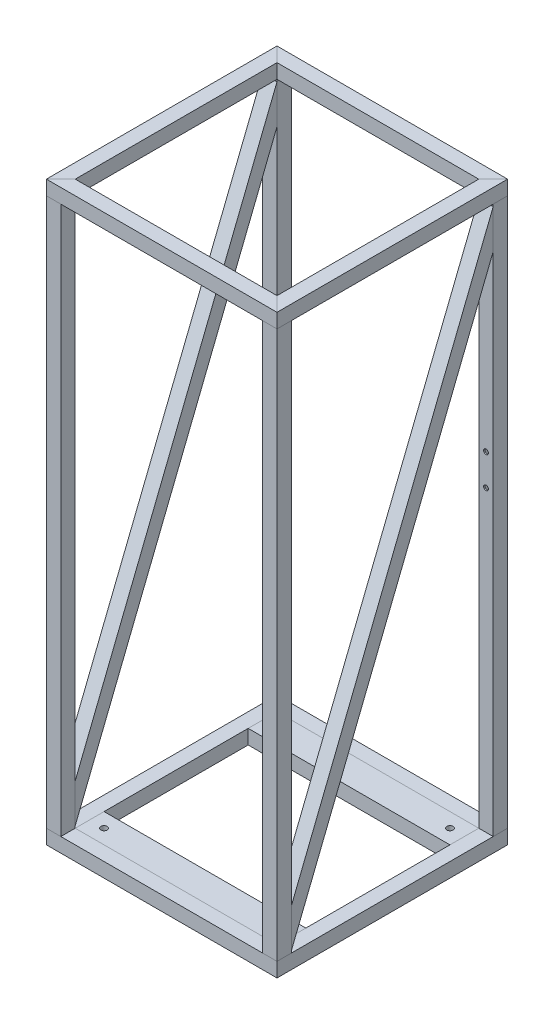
SolidWorks part; units mm, degrees
ref_plane "Front Plane" through (0, 0, 0) normal (0, 0, 1) x (1, 0, 0)
ref_plane "Top Plane" through (0, 0, 0) normal (0, 1, 0) x (1, 0, 0)
ref_plane "Right Plane" through (0, 0, 0) normal (1, 0, 0) x (0, 0, -1)
sketch3d "3DSketch7"
  line L0 (0, 0, 0) -> (609.6, 0, 0)
  line L1 (609.6, 0, 0) -> (609.6, 1524, 0)
  line L2 (609.6, 1524, 0) -> (0, 1524, 0)
  line L3 (0, 1524, 0) -> (0, 0, 0)
  line L4 (0, 0, 0) -> (0, 0, 609.6)
  line L5 (0, 0, 609.6) -> (0, 1524, 609.6)
  line L6 (0, 1524, 609.6) -> (0, 1524, 0)
  line L7 (0, 0, 609.6) -> (609.6, 0, 609.6)
  line L8 (609.6, 0, 609.6) -> (609.6, 0, 0)
  line L9 (609.6, 1524, 0) -> (609.6, 1524, 609.6)
  line L10 (609.6, 1524, 609.6) -> (0, 1524, 609.6)
  line L11 (609.6, 1524, 609.6) -> (609.6, 0, 609.6)
  line L12 (609.6, 1524, 0) -> (609.6, 0, 609.6)
  line L13 (0, 1524, 0) -> (0, 0, 609.6)
  line L14 (0, 0, 609.6) -> (0, 0, 608.3224)
other "Structural Member6"
ref_plane "Plane8" through (0, 0, 609.6) normal (0, 1, 0) x (-1, 0, 0)
sketch "Sketch1" plane through (19.05, 0, 590.55) normal (0, 1, 0) x (-1, 0, 0)
  line L1 (-19.05, 19.05) -> (19.05, 19.05)
  line L2 (-19.05, 19.05) -> (-19.05, -19.05)
  line L3 (-19.05, -19.05) -> (19.05, -19.05)
  line L4 (19.05, 19.05) -> (19.05, -19.05)
  line L5 (15.875, 15.875) -> (15.875, -15.875)
  line L6 (-15.875, -15.875) -> (15.875, -15.875)
  line L7 (-15.875, 15.875) -> (-15.875, -15.875)
  line L8 (-15.875, 15.875) -> (15.875, 15.875)
  point P6 (0, 0)
  dimension "D1" = 38.1
  dimension "D2" = 38.1
  dimension "D4" = 19.05
  dimension "D5" = 19.05
  dimension "D3" = 3.175
other "Structural Member7"
ref_plane "Plane9" through (0, 1524, 0) normal (0, -1, 0) x (1, 0, 0)
sketch "Sketch14" plane through (19.05, 1524, 19.05) normal (0, -1, 0) x (1, 0, 0)
  line L1 (-19.05, 19.05) -> (19.05, 19.05)
  line L2 (-19.05, 19.05) -> (-19.05, -19.05)
  line L3 (-19.05, -19.05) -> (19.05, -19.05)
  line L4 (19.05, 19.05) -> (19.05, -19.05)
  line L5 (15.875, 15.875) -> (15.875, -15.875)
  line L6 (-15.875, -15.875) -> (15.875, -15.875)
  line L7 (-15.875, 15.875) -> (-15.875, -15.875)
  line L8 (-15.875, 15.875) -> (15.875, 15.875)
  point P6 (0, 0)
  dimension "D1" = 38.1
  dimension "D2" = 38.1
  dimension "D4" = 19.05
  dimension "D5" = 19.05
  dimension "D3" = 3.175
other "Structural Member8"
ref_plane "Plane10" through (609.6, 1524, 609.6) normal (0, -1, 0) x (1, 0, 0)
sketch "Sketch15" plane through (590.55, 1524, 590.55) normal (0, -1, 0) x (1, 0, 0)
  line L1 (-19.05, 19.05) -> (19.05, 19.05)
  line L2 (-19.05, 19.05) -> (-19.05, -19.05)
  line L3 (-19.05, -19.05) -> (19.05, -19.05)
  line L4 (19.05, 19.05) -> (19.05, -19.05)
  line L5 (15.875, 15.875) -> (15.875, -15.875)
  line L6 (-15.875, -15.875) -> (15.875, -15.875)
  line L7 (-15.875, 15.875) -> (-15.875, -15.875)
  line L8 (-15.875, 15.875) -> (15.875, 15.875)
  point P6 (0, 0)
  dimension "D1" = 38.1
  dimension "D2" = 38.1
  dimension "D4" = 19.05
  dimension "D5" = 19.05
  dimension "D3" = 3.175
other "Structural Member9"
ref_plane "Plane11" through (0, 1524, 0) normal (0, -0.9285, 0.3714) x (1, 0, 0)
sketch "Sketch16" plane through (19.05, 1524, 0) normal (0, -0.9285, 0.3714) x (1, 0, 0)
  line L1 (-19.05, 19.05) -> (19.05, 19.05)
  line L2 (-19.05, 19.05) -> (-19.05, -19.05)
  line L3 (-19.05, -19.05) -> (19.05, -19.05)
  line L4 (19.05, 19.05) -> (19.05, -19.05)
  line L5 (15.875, 15.875) -> (15.875, -15.875)
  line L6 (-15.875, -15.875) -> (15.875, -15.875)
  line L7 (-15.875, 15.875) -> (-15.875, -15.875)
  line L8 (-15.875, 15.875) -> (15.875, 15.875)
  point P6 (0, 0)
  point P10 (-19.05, 0)
  dimension "D1" = 38.1
  dimension "D2" = 38.1
  dimension "D4" = 19.05
  dimension "D5" = 19.05
  dimension "D3" = 3.175
other "Structural Member10"
ref_plane "Plane12" through (609.6, 1524, 0) normal (0, -0.9285, 0.3714) x (1, 0, 0)
sketch "Sketch17" plane through (590.55, 1524, 0) normal (0, -0.9285, 0.3714) x (1, 0, 0)
  line L0 (-590.55, 19.05) -> (-590.55, -19.05) construction
  line L1 (-19.05, 19.05) -> (19.05, 19.05)
  line L2 (-19.05, 19.05) -> (-19.05, -19.05)
  line L3 (-19.05, -19.05) -> (19.05, -19.05)
  line L4 (19.05, 19.05) -> (19.05, -19.05)
  line L5 (15.875, 15.875) -> (15.875, -15.875)
  line L6 (-15.875, -15.875) -> (15.875, -15.875)
  line L7 (-15.875, 15.875) -> (-15.875, -15.875)
  line L8 (-15.875, 15.875) -> (15.875, 15.875)
  line L9 (-552.45, 19.05) -> (-590.55, 19.05) construction
  line L10 (-552.45, -19.05) -> (-552.45, 19.05) construction
  line L11 (-590.55, -19.05) -> (-552.45, -19.05) construction
  point P6 (0, 0)
  point P10 (-590.55, 0)
  point P11 (-571.5, 19.05)
  point P14 (-552.45, 0)
  point P17 (-571.5, -19.05)
  point P20 (19.05, 0)
  dimension "D1" = 38.1
  dimension "D2" = 38.1
  dimension "D4" = 19.05
  dimension "D5" = 19.05
  dimension "D3" = 3.175
other "Structural Member11"
ref_plane "Plane13" through (609.6, 0, 0) normal (0, 1, 0) x (-1, 0, 0)
sketch "Sketch18" plane through (590.55, 0, 19.05) normal (0, 1, 0) x (-1, 0, 0)
  line L1 (-19.05, 19.05) -> (19.05, 19.05)
  line L2 (-19.05, 19.05) -> (-19.05, -19.05)
  line L3 (-19.05, -19.05) -> (19.05, -19.05)
  line L4 (19.05, 19.05) -> (19.05, -19.05)
  line L5 (15.875, 15.875) -> (15.875, -15.875)
  line L6 (-15.875, -15.875) -> (15.875, -15.875)
  line L7 (-15.875, 15.875) -> (-15.875, -15.875)
  line L8 (-15.875, 15.875) -> (15.875, 15.875)
  point P6 (0, 0)
  dimension "D1" = 38.1
  dimension "D2" = 38.1
  dimension "D4" = 19.05
  dimension "D5" = 19.05
  dimension "D3" = 3.175
other "Structural Member12"
ref_plane "Plane14" through (609.6, 1524, 609.6) normal (-1, 0, 0) x (0, 0, 1)
sketch "Sketch19" plane through (609.6, 1504.95, 590.55) normal (-1, 0, 0) x (0, 0, 1)
  line L1 (-19.05, 19.05) -> (19.05, 19.05)
  line L2 (-19.05, 19.05) -> (-19.05, -19.05)
  line L3 (-19.05, -19.05) -> (19.05, -19.05)
  line L4 (19.05, 19.05) -> (19.05, -19.05)
  line L5 (15.875, 15.875) -> (15.875, -15.875)
  line L6 (-15.875, -15.875) -> (15.875, -15.875)
  line L7 (-15.875, 15.875) -> (-15.875, -15.875)
  line L8 (-15.875, 15.875) -> (15.875, 15.875)
  point P6 (0, 0)
  dimension "D1" = 38.1
  dimension "D2" = 38.1
  dimension "D4" = 19.05
  dimension "D5" = 19.05
  dimension "D3" = 3.175
other "Structural Member13"
ref_plane "Plane15" through (0, 1524, 609.6) normal (0, 0, -1) x (-1, 0, 0)
sketch "Sketch110" plane through (19.05, 1504.95, 609.6) normal (0, 0, -1) x (-1, 0, 0)
  line L1 (-19.05, 19.05) -> (19.05, 19.05)
  line L2 (-19.05, 19.05) -> (-19.05, -19.05)
  line L3 (-19.05, -19.05) -> (19.05, -19.05)
  line L4 (19.05, 19.05) -> (19.05, -19.05)
  line L5 (15.875, 15.875) -> (15.875, -15.875)
  line L6 (-15.875, -15.875) -> (15.875, -15.875)
  line L7 (-15.875, 15.875) -> (-15.875, -15.875)
  line L8 (-15.875, 15.875) -> (15.875, 15.875)
  point P6 (0, 0)
  dimension "D1" = 38.1
  dimension "D2" = 38.1
  dimension "D4" = 19.05
  dimension "D5" = 19.05
  dimension "D3" = 3.175
other "Structural Member14"
ref_plane "Plane16" through (609.6, 1524, 0) normal (-1, 0, 0) x (0, 0, 1)
sketch "Sketch111" plane through (609.6, 1504.95, 19.05) normal (-1, 0, 0) x (0, 0, 1)
  line L1 (-19.05, 19.05) -> (19.05, 19.05)
  line L2 (-19.05, 19.05) -> (-19.05, -19.05)
  line L3 (-19.05, -19.05) -> (19.05, -19.05)
  line L4 (19.05, 19.05) -> (19.05, -19.05)
  line L5 (15.875, 15.875) -> (15.875, -15.875)
  line L6 (-15.875, -15.875) -> (15.875, -15.875)
  line L7 (-15.875, 15.875) -> (-15.875, -15.875)
  line L8 (-15.875, 15.875) -> (15.875, 15.875)
  point P6 (0, 0)
  dimension "D1" = 38.1
  dimension "D2" = 38.1
  dimension "D4" = 19.05
  dimension "D5" = 19.05
  dimension "D3" = 3.175
other "Structural Member15"
ref_plane "Plane17" through (0, 0, 609.6) normal (1, 0, 0) x (0, 0, -1)
sketch "Sketch112" plane through (0, 19.05, 590.55) normal (1, 0, 0) x (0, 0, -1)
  line L1 (-19.05, 19.05) -> (19.05, 19.05)
  line L2 (-19.05, 19.05) -> (-19.05, -19.05)
  line L3 (-19.05, -19.05) -> (19.05, -19.05)
  line L4 (19.05, 19.05) -> (19.05, -19.05)
  line L5 (15.875, 15.875) -> (15.875, -15.875)
  line L6 (-15.875, -15.875) -> (15.875, -15.875)
  line L7 (-15.875, 15.875) -> (-15.875, -15.875)
  line L8 (-15.875, 15.875) -> (15.875, 15.875)
  point P6 (0, 0)
  dimension "D1" = 38.1
  dimension "D2" = 38.1
  dimension "D4" = 19.05
  dimension "D5" = 19.05
  dimension "D3" = 3.175
other "Structural Member16"
ref_plane "Plane18" through (0, 0, 0) normal (0, 0, 1) x (1, 0, 0)
sketch "Sketch113" plane through (19.05, 19.05, 0) normal (0, 0, 1) x (1, 0, 0)
  line L1 (-19.05, 19.05) -> (19.05, 19.05)
  line L2 (-19.05, 19.05) -> (-19.05, -19.05)
  line L3 (-19.05, -19.05) -> (19.05, -19.05)
  line L4 (19.05, 19.05) -> (19.05, -19.05)
  line L5 (15.875, 15.875) -> (15.875, -15.875)
  line L6 (-15.875, -15.875) -> (15.875, -15.875)
  line L7 (-15.875, 15.875) -> (-15.875, -15.875)
  line L8 (-15.875, 15.875) -> (15.875, 15.875)
  point P6 (0, 0)
  dimension "D1" = 38.1
  dimension "D2" = 38.1
  dimension "D4" = 19.05
  dimension "D5" = 19.05
  dimension "D3" = 3.175
other "Structural Member17"
ref_plane "Plane19" through (0, 0, 0) normal (1, 0, 0) x (0, 0, -1)
sketch "Sketch114" plane through (0, 19.05, 19.05) normal (1, 0, 0) x (0, 0, -1)
  line L1 (-19.05, 19.05) -> (19.05, 19.05)
  line L2 (-19.05, 19.05) -> (-19.05, -19.05)
  line L3 (-19.05, -19.05) -> (19.05, -19.05)
  line L4 (19.05, 19.05) -> (19.05, -19.05)
  line L5 (15.875, 15.875) -> (15.875, -15.875)
  line L6 (-15.875, -15.875) -> (15.875, -15.875)
  line L7 (-15.875, 15.875) -> (-15.875, -15.875)
  line L8 (-15.875, 15.875) -> (15.875, 15.875)
  point P6 (0, 0)
  dimension "D1" = 38.1
  dimension "D2" = 38.1
  dimension "D4" = 19.05
  dimension "D5" = 19.05
  dimension "D3" = 3.175
other "Structural Member18"
ref_plane "Plane20" through (609.6, 0, 609.6) normal (0, 0, -1) x (-1, 0, 0)
sketch "Sketch115" plane through (590.55, 19.05, 609.6) normal (0, 0, -1) x (-1, 0, 0)
  line L1 (-19.05, 19.05) -> (19.05, 19.05)
  line L2 (-19.05, 19.05) -> (-19.05, -19.05)
  line L3 (-19.05, -19.05) -> (19.05, -19.05)
  line L4 (19.05, 19.05) -> (19.05, -19.05)
  line L5 (15.875, 15.875) -> (15.875, -15.875)
  line L6 (-15.875, -15.875) -> (15.875, -15.875)
  line L7 (-15.875, 15.875) -> (-15.875, -15.875)
  line L8 (-15.875, 15.875) -> (15.875, 15.875)
  point P6 (0, 0)
  dimension "D1" = 38.1
  dimension "D2" = 38.1
  dimension "D4" = 19.05
  dimension "D5" = 19.05
  dimension "D3" = 3.175
other "Trim/Extend1"
other "Trim/Extend2"
other "Trim/Extend3"
other "Trim/Extend4"
other "Trim/Extend5"
other "Trim/Extend6"
other "Trim/Extend7"
other "Trim/Extend10"
other "Trim/Extend11"
other "Trim/Extend14"
other "Trim/Extend15"
other "Trim/Extend17"
other "Trim/Extend18"
other "Gusset2" parameters "D1"=6.35, "D2"=6.35, "D3"=0, "D4"=0, "D10"=6.35, "D11"=152.4, "D12"=152.4, "D13"=12.7, "D14"=45, "D15"=12.7
sketch "Sketch117" plane through (38.1, 1485.9, 590.55) normal (0, 0, 1) x (1, 0, 0)
  line L0 (0, 0) -> (152.4, 0)
  line L1 (0, 0) -> (0, -152.4)
  line L2 (152.4, 0) -> (0, -152.4)
other "Gusset3" parameters "D1"=6.35, "D2"=6.35, "D3"=0, "D4"=0, "D10"=6.35, "D11"=152.4, "D12"=152.4, "D13"=12.7, "D14"=45, "D15"=12.7
sketch "Sketch118" plane through (571.5, 1485.9, 590.55) normal (0, 0, -1) x (-1, 0, 0)
  line L0 (0, 0) -> (152.4, 0)
  line L1 (0, 0) -> (0, -152.4)
  line L2 (152.4, 0) -> (0, -152.4)
sketch "Sketch119" plane through (0, 0, 38.1) normal (0, 0, 1) x (1, 0, 0)
  line L1 (38.1, 0) -> (571.5, 0)
  line L2 (38.1, 0) -> (38.1, 38.1)
  line L3 (38.1, 38.1) -> (571.5, 38.1)
  line L4 (571.5, 0) -> (571.5, 38.1)
extrude "Extrude2" add sketch "Sketch119" along normal blind 76.2 separate body
sketch "Sketch120" plane through (0, 0, 571.5) normal (0, 0, -1) x (-1, 0, 0)
  line L1 (-571.5, 0) -> (-38.1, 0)
  line L2 (-571.5, 0) -> (-571.5, 38.1)
  line L3 (-571.5, 38.1) -> (-38.1, 38.1)
  line L4 (-38.1, 0) -> (-38.1, 38.1)
extrude "Extrude3" add sketch "Sketch120" along normal blind 76.2 separate body
sketch "Sketch122" plane through (0, 38.1, 0) normal (0, 1, 0) x (-1, 0, 0)
  line L0 (-571.5, 38.1) -> (-38.1, 38.1) construction
  line L1 (-38.1, 114.3) -> (-38.1, 38.1) construction
  line L2 (-571.5, 114.3) -> (-571.5, 38.1) construction
  line L4 (-38.1, 571.5) -> (-571.5, 571.5) construction
  line L5 (-38.1, 495.3) -> (-38.1, 571.5) construction
  line L6 (-571.5, 495.3) -> (-571.5, 571.5) construction
  circle A0 centre (-76.2, 76.2) radius 8.382
  circle A1 centre (-533.4, 76.2) radius 8.382
  circle A2 centre (-533.4, 533.4) radius 8.382
  circle A3 centre (-76.2, 533.4) radius 8.382
  dimension "D1" = 16.764
  dimension "D2" = 38.1
  dimension "D3" = 38.1
  dimension "D4" = 38.1
  dimension "D5" = 38.1
  dimension "D6" = 38.1
  dimension "D7" = 38.1
  dimension "D8" = 38.1
  dimension "D9" = 38.1
extrude "Cut-Extrude1" cut sketch "Sketch122" against normal through all
sketch "Sketch123" plane through (0, 0, 38.1) normal (0, 0, 1) x (1, 0, 0)
  line L0 (0, 38.1) -> (0, 1485.9) construction
  line L1 (609.6, 1485.9) -> (609.6, 38.1) construction
  circle A0 centre (19.05, 903.0242) radius 6.35
  circle A1 centre (590.55, 909.3742) radius 6.35
  circle A2 centre (19.05, 826.8242) radius 6.35
  circle A3 centre (590.55, 826.8242) radius 6.35
  dimension "D1" = 19.05
  dimension "D2" = 19.05
  dimension "D3" = 76.2
extrude "Cut-Extrude2" cut sketch "Sketch123" against normal up to next
